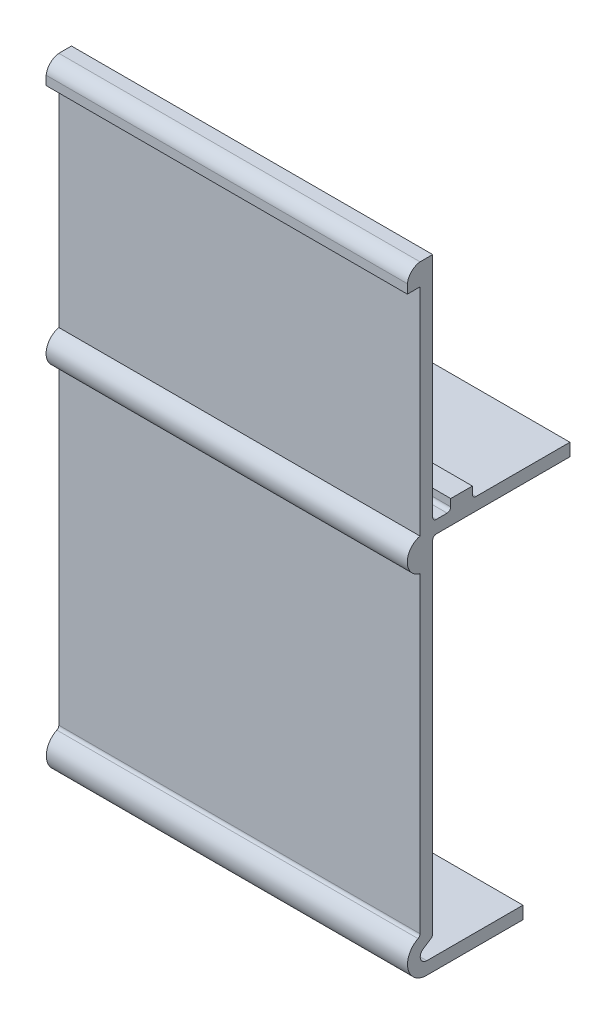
SolidWorks part; units mm, degrees
ref_plane "Front Plane" through (0, 0, 0) normal (0, 0, 1) x (1, 0, 0)
ref_plane "Top Plane" through (0, 0, 0) normal (0, 1, 0) x (1, 0, 0)
ref_plane "Right Plane" through (0, 0, 0) normal (1, 0, 0) x (0, 0, -1)
sketch "Sketch1" plane through (0, 0, 0) normal (1, 0, 0) x (0, 0, -1)
  line L0 (1.6786, 103.5) -> (1.6786, 9.0791)
  line L1 (39.6786, 108) -> (13.6786, 108)
  line L2 (1.6786, 109) -> (1.6786, 172)
  line L3 (-0.9333, 6.8494) -> (1.2206, 8.2388)
  line L4 (0, 0) -> (26.6786, 0)
  line L5 (-1.8214, 97.25) -> (-1.8214, 10.8988)
  line L6 (-1.8214, 166) -> (-1.8214, 106.25)
  line L7 (-5.3214, 166) -> (-1.8214, 166)
  line L8 (-5.3214, 168.5) -> (-5.3214, 166)
  line L9 (12.6786, 111) -> (12.6786, 109)
  line L10 (6.6786, 111) -> (12.6786, 111)
  line L11 (5.6786, 108) -> (2.6786, 108)
  line L12 (6.6786, 109) -> (6.6786, 111)
  line L13 (1.6786, 172) -> (-1.8214, 172)
  line L14 (39.6786, 104.5) -> (39.6786, 108)
  line L15 (2.6786, 104.5) -> (39.6786, 104.5)
  line L16 (26.6786, 3.5) -> (0.0533, 3.5)
  line L17 (26.6786, 0) -> (26.6786, 3.5)
  arc A0 (-2.3724, 10.0053) -> (0, 0) centre (0, 5.2839) ccw
  arc A1 (-1.8214, 106.25) -> (-1.8214, 97.25) centre (-0.7164, 101.75) ccw
  arc A2 (-1.8214, 172) -> (-5.3214, 168.5) centre (-1.3494, 168.028) ccw
  arc A3 (1.2206, 8.2388) -> (1.6786, 9.0791) centre (0.6786, 9.0791) ccw
  arc A4 (-2.3724, 10.0053) -> (-1.8214, 10.8988) centre (-2.8214, 10.8988) ccw
  arc A5 (12.6786, 109) -> (13.6786, 108) centre (13.6786, 109) ccw
  arc A6 (5.6786, 108) -> (6.6786, 109) centre (5.6786, 109) ccw
  arc A7 (1.6786, 109) -> (2.6786, 108) centre (2.6786, 109) ccw
  arc A8 (2.6786, 104.5) -> (1.6786, 103.5) centre (2.6786, 103.5) ccw
  arc A9 (-0.9333, 6.8494) -> (0.0533, 3.5) centre (0.0533, 5.32) ccw
extrude "Extrude1" add sketch "Sketch1" against normal mid plane 100
